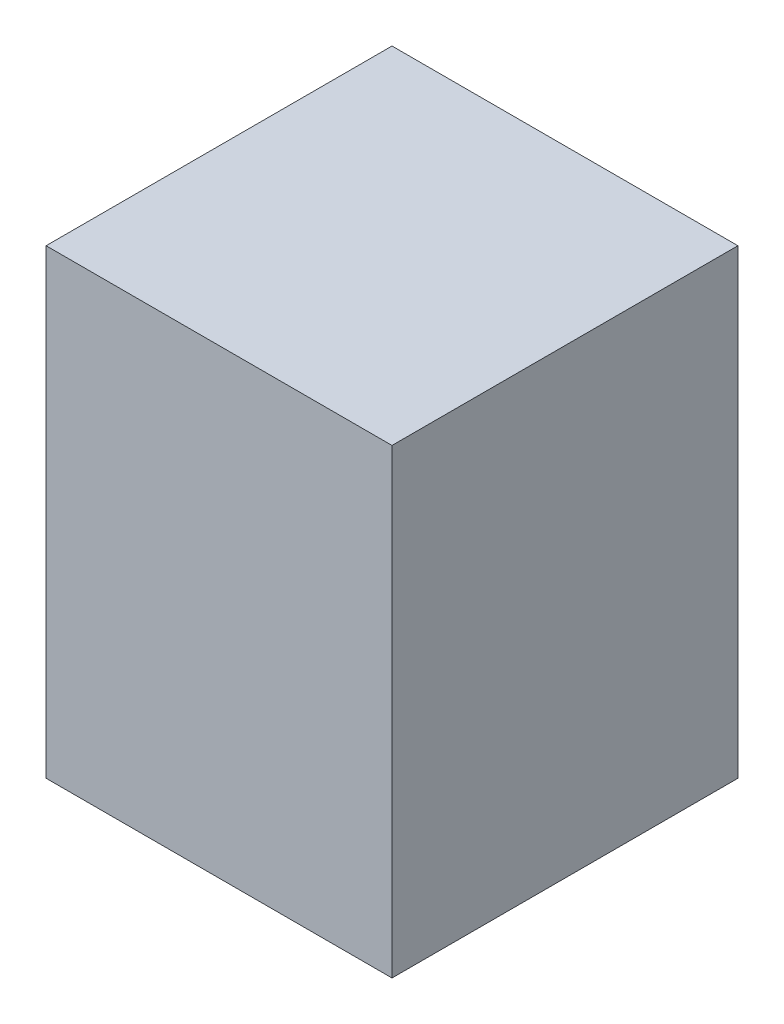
SolidWorks part; units mm, degrees
ref_plane "Plan de face" through (0, 0, 0) normal (0, 0, 1) x (1, 0, 0)
ref_plane "Plan de dessus" through (0, 0, 0) normal (0, 1, 0) x (1, 0, 0)
ref_plane "Plan de droite" through (0, 0, 0) normal (1, 0, 0) x (0, 0, -1)
sketch "Esquisse1" plane through (0, 0, 0) normal (0, 0, 1) x (1, 0, 0)
  line L0 (0, 0) -> (470.6608, 0) construction
  line L1 (0, -55.3377) -> (0, 353.7921) construction
  line L2 (0, 0) -> (442.2765, 160.9755) construction
  line L3 (0, 0) -> (360.5471, 302.5349) construction
  line L4 (0, 0) -> (235.3304, 407.6042) construction
  line L5 (0, 0) -> (81.7294, 463.5104) construction
  line L6 (0, 0) -> (-81.7294, 463.5104) construction
  line L7 (0, 0) -> (-235.3304, 407.6042) construction
  line L8 (0, 0) -> (-360.5471, 302.5349) construction
  line L9 (0, 0) -> (-442.2765, 160.9755) construction
  line L10 (0, 0) -> (-470.6608, 0) construction
  line L11 (-390.3547, -30) -> (366.2536, -30) construction
  line L12 (-390.3547, 30) -> (366.2536, 30) construction
  line L13 (-390.3547, 60) -> (366.2536, 60) construction
  line L14 (22.5, -55.3377) -> (22.5, 160.9755) construction
  line L15 (366.2536, 90) -> (-390.3547, 90) construction
  line L16 (45, -55.3377) -> (45, 160.9755) construction
  line L17 (-390.3547, 120) -> (366.2536, 120) construction
  line L18 (-90, -59.8279) -> (-90, 0) construction
  line L19 (366.2536, 150) -> (-390.3547, 150) construction
  line L20 (67.5, -55.3377) -> (67.5, 160.9755) construction
  line L21 (90, -55.3377) -> (90, 160.9755) construction
  line L22 (112.5, -55.3377) -> (112.5, 160.9755) construction
  line L23 (135, -55.3377) -> (135, 160.9755) construction
  line L24 (157.5, -55.3377) -> (157.5, 160.9755) construction
  line L25 (180, -55.3377) -> (180, 160.9755) construction
  line L26 (202.5, -55.3377) -> (202.5, 160.9755) construction
  line L27 (225, -55.3377) -> (225, 160.9755) construction
  line L29 (135, 0) -> (157.5, 0)
  line L30 (135, 0) -> (135, -30)
  line L31 (135, -30) -> (157.5, -30)
  line L32 (157.5, 0) -> (157.5, -30)
  arc A0 (90, 0) -> (-90, 0) centre (0, 0) ccw construction
  arc A1 (112, 0) -> (-112, 0) centre (0, 0) ccw construction
extrude "Extrusion1" add sketch "Esquisse1" along normal blind 22.5
